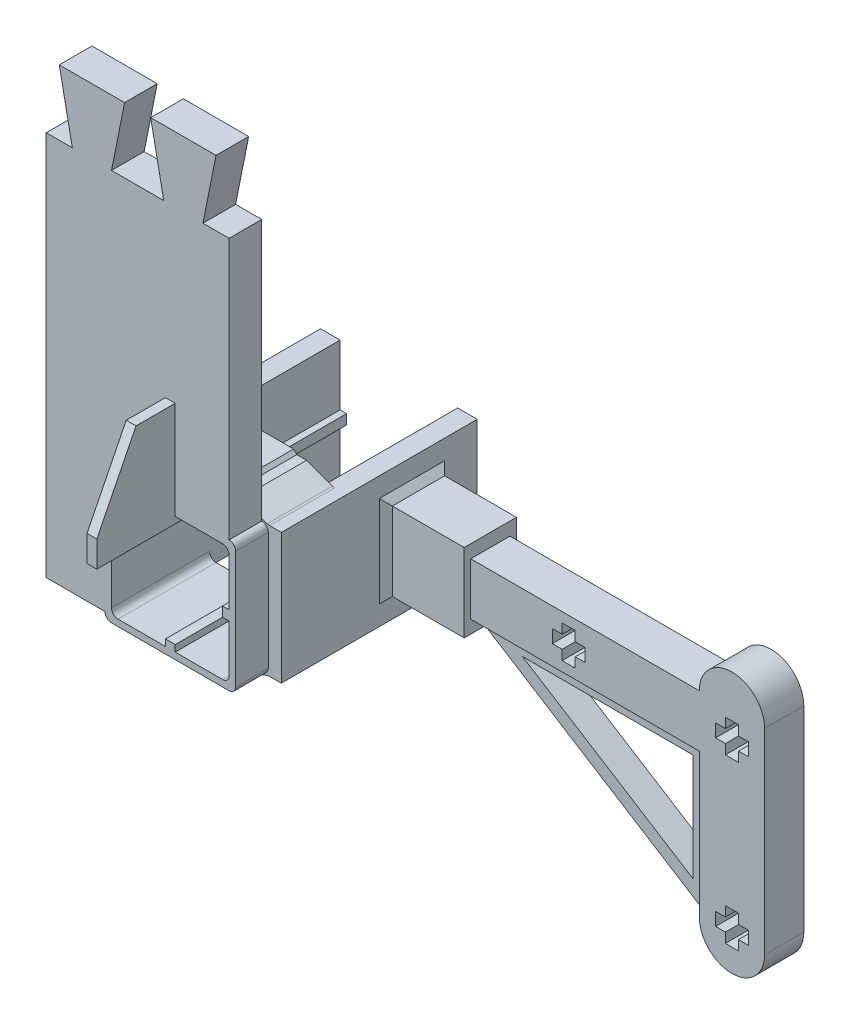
SolidWorks part; units mm, degrees
ref_plane "前视基准面" through (0, 0, 0) normal (0, 0, 1) x (1, 0, 0)
ref_plane "上视基准面" through (0, 0, 0) normal (0, 1, 0) x (1, 0, 0)
ref_plane "右视基准面" through (0, 0, 0) normal (1, 0, 0) x (0, 0, -1)
sketch "草图1" plane through (0, 0, 0) normal (0, 0, 1) x (1, 0, 0)
  line L0 (-10, 10) -> (-10, -10)
  line L1 (9, 9) -> (-9, 9)
  line L2 (9, 9) -> (9, -9)
  line L3 (9, -9) -> (-9, -9)
  line L4 (-9, 9) -> (-9, -9)
  line L5 (9, 9) -> (-9, -9) construction
  line L6 (9, -9) -> (-9, 9) construction
  line L7 (10, -10) -> (-10, -10)
  line L8 (10, 10) -> (10, -10)
  line L9 (10, 10) -> (-10, 10)
  line L10 (-10, 10) -> (-11.5, 5.8788)
  line L11 (-11.5, -4.3788) -> (-12, -3.8788)
  line L12 (-11.5, 5.8788) -> (-11.5, 4.3788)
  line L13 (-11.5, 4.3788) -> (-12, 3.8788)
  line L14 (-12, 3.8788) -> (-12, -3.8788)
  line L15 (-12, 0) -> (0, 0) construction
  line L16 (-11.5, -5.8788) -> (-11.5, -4.3788)
  line L17 (-10, -10) -> (-11.5, -5.8788)
  line L18 (10, 10) -> (5.8788, 11.5)
  line L19 (5.8788, 11.5) -> (4.3788, 11.5)
  line L20 (4.3788, 11.5) -> (3.8788, 12)
  line L21 (3.8788, 12) -> (-3.8788, 12)
  line L22 (-4.3788, 11.5) -> (-3.8788, 12)
  line L23 (-5.8788, 11.5) -> (-4.3788, 11.5)
  line L24 (-10, 10) -> (-5.8788, 11.5)
  line L25 (10, -10) -> (11.5, -5.8788)
  line L26 (11.5, -5.8788) -> (11.5, -4.3788)
  line L27 (11.5, -4.3788) -> (12, -3.8788)
  line L28 (12, -3.8788) -> (12, 3.8788)
  line L29 (11.5, 4.3788) -> (12, 3.8788)
  line L30 (11.5, 5.8788) -> (11.5, 4.3788)
  line L31 (10, 10) -> (11.5, 5.8788)
  line L32 (-10, -10) -> (-5.8788, -11.5)
  line L33 (-5.8788, -11.5) -> (-4.3788, -11.5)
  line L34 (-4.3788, -11.5) -> (-3.8788, -12)
  line L35 (-3.8788, -12) -> (3.8788, -12)
  line L36 (4.3788, -11.5) -> (3.8788, -12)
  line L37 (5.8788, -11.5) -> (4.3788, -11.5)
  line L38 (10, -10) -> (5.8788, -11.5)
  point P0 (0, 0)
  point P45 (0, 0)
  dimension "D1" = 18
  dimension "D2" = 18
  dimension "D4" = 2
  dimension "D5" = 0.5
  dimension "D6" = 20
  dimension "D7" = 1.5
  dimension "D8" = 135
  dimension "D3" = 1
  dimension "D9" = 4
extrude "凸台-拉伸1" add sketch "草图1" along normal blind 10 contours L24 L9 L18 L19 L20 L21 L22 L23 | L8 L9 L0 L7 L4 L1 L2 L3 | L38 L7 L32 L33 L34 L35 L36 L37 | L17 L0 L10 L12 L13 L14 L11 L16
sketch "草图2" plane through (0, 0, 0) normal (0, 0, -1) x (-1, 0, 0)
  line L0 (-10, 10) -> (-12, 10)
  line L1 (-12, 10) -> (-12, -10)
  line L2 (-12, -10) -> (-10, -10)
  line L3 (-10, -10) -> (-10, 10)
  dimension "D1" = 2
extrude "凸台-拉伸2" add sketch "草图2" against normal blind 10
sketch "草图3" plane through (0, 0, 0) normal (0, 0, -1) x (-1, 0, 0)
  line L0 (-9, 9) -> (-9, -9) construction
  line L1 (-12, 10) -> (-9, 10)
  line L2 (-12, 10) -> (-12, -10)
  line L3 (-12, -10) -> (-9, -10)
  line L4 (-9, 10) -> (-9, -10)
extrude "凸台-拉伸3" add sketch "草图3" along normal blind 20
fillet "圆角1" radius 1 8 edges at (-9, -9, 5) (-9, 9, 5) (9, 9, 5) (9, -9, 5) (-10, 10, 5) (-10, -10, 5) (10, -10, 5) (10, 10, 5)
sketch "草图4" plane through (0, 0, 0) normal (0, 0, -1) x (-1, 0, 0)
  line L0 (-8, 9) -> (8, 9) construction
  line L1 (0.75, 10) -> (-0.75, 10)
  line L2 (0.75, 10) -> (0.75, 8)
  line L3 (0.75, 8) -> (-0.75, 8)
  line L4 (-0.75, 10) -> (-0.75, 8)
  line L5 (0.75, 10) -> (-0.75, 8) construction
  line L6 (0.75, 8) -> (-0.75, 10) construction
  line L7 (10, 0.75) -> (8, 0.75)
  line L8 (10, -0.75) -> (10, 0.75)
  line L9 (10, -0.75) -> (8, -0.75)
  line L10 (8, -0.75) -> (8, 0.75)
  line L11 (0.75, -10) -> (0.75, -8)
  line L12 (-0.75, -10) -> (0.75, -10)
  line L13 (-0.75, -10) -> (-0.75, -8)
  line L14 (-0.75, -8) -> (0.75, -8)
  line L15 (-10, -0.75) -> (-8, -0.75)
  line L16 (-10, 0.75) -> (-10, -0.75)
  line L17 (-10, 0.75) -> (-8, 0.75)
  line L18 (-8, 0.75) -> (-8, -0.75)
  point P0 (0, 9)
  point P22 (0, 0)
  dimension "D1" = 2
  dimension "D2" = 1.5
  dimension "D3" = 4
extrude "凸台-拉伸4" add sketch "草图4" against normal up to surface (10 mm away)
ref_plane "基准面1" through (0, 0, -10) normal (0, 0, -1) x (-1, 0, 0)
sketch "草图5" plane through (0, 0, -10) normal (0, 0, -1) x (-1, 0, 0)
  line L5 (-12, 10) -> (-12, -10) construction
  line L6 (-24, 6) -> (-12, 6)
  line L7 (-24, 6) -> (-24, -6)
  line L8 (-24, -6) -> (-12, -6)
  line L9 (-12, 6) -> (-12, -6)
  line L10 (-24, 6) -> (-12, -6) construction
  line L11 (-24, -6) -> (-12, 6) construction
  line L12 (-18, 0) -> (0, 0) construction
  point P0 (-18, 0)
  dimension "D1" = 12
  dimension "D2" = 12
extrude "凸台-拉伸8" add sketch "草图5" along normal mid plane 8
sketch "草图8" plane through (24, 0, 0) normal (1, 0, 0) x (0, 0, -1)
  line L0 (0, 0) -> (10, 0) construction
  line L1 (13, 4) -> (7, 4)
  line L2 (13, 4) -> (13, -4)
  line L3 (13, -4) -> (7, -4)
  line L4 (7, 4) -> (7, -4)
  line L5 (13, 4) -> (7, -4) construction
  line L6 (13, -4) -> (7, 4) construction
  line L7 (14, 6) -> (14, -6) construction
  point P0 (10, 0)
  dimension "D1" = 4
  dimension "D2" = 8
  dimension "D3" = 6
extrude "凸台-拉伸9" add sketch "草图8" along normal blind 35
sketch "草图9" plane through (0, 0, -10) normal (0, 0, -1) x (-1, 0, 0)
  line L0 (-64, 4) -> (-64, -26) construction
  line L1 (-59, 4) -> (-59, -26)
  line L2 (-69, 4) -> (-69, -26)
  line L3 (-64, 4) -> (-59, 4) construction
  line L4 (-59, -4) -> (-59, 4) construction
  arc A0 (-59, 4) -> (-69, 4) centre (-64, 4) ccw
  arc A1 (-69, -26) -> (-59, -26) centre (-64, -26) ccw
  point P2 (-64, -11)
  dimension "D1" = 5
  dimension "D2" = 30
extrude "凸台-拉伸10" add sketch "草图9" along normal mid plane 6
chamfer "倒角1" distance 1 angle 45 4 edges at (12, 0, -14) (12, -6, -10) (12, 0, -6) (12, 6, -10)
sketch "草图10" plane through (0, 0, -10) normal (0, 0, -1) x (-1, 0, 0)
  line L0 (-24, -4) -> (-59, -26)
rib "筋1" sketch "草图10" sketch "草图10" thickness 4 extrusion direction parallel to sketch draft on no parameters "D1"=4
sketch "草图11" plane through (0, 0, -10) normal (0, 0, -1) x (-1, 0, 0)
  line L0 (-57, -6) -> (-57, -22.3806)
  line L1 (-57, -22.3806) -> (-30.94, -6)
  line L2 (-30.94, -6) -> (-57, -6)
  line L3 (-24, -4) -> (-59, -4)
  line L4 (-59, -4) -> (-59, -26)
  line L5 (-59, -26) -> (-24, -4)
  line L6 (-24, -4) -> (-59, -4)
  line L7 (-59, -4) -> (-59, -26)
  line L8 (-59, -26) -> (-24, -4)
  dimension "D1" = 0
  dimension "D2" = 2
extrude "切除-拉伸1" cut sketch "草图11" against normal through all both and the other way through all contours L0 L1 L2
sketch "草图13" plane through (0, 0, 10) normal (0, 0, 1) x (1, 0, 0)
  line L1 (8, 9) -> (-8, 9)
  line L2 (9, 8) -> (9, -8)
  line L3 (8, -9) -> (-8, -9)
  line L4 (-9, 8) -> (-9, -8)
  line L5 (9, 9) -> (-9, -9) construction
  line L6 (9, -9) -> (-9, 9) construction
  line L7 (9, 10) -> (-9, 10)
  line L8 (10, 9) -> (10, -9)
  line L9 (9, -10) -> (-9, -10)
  line L10 (-10, 9) -> (-10, -9)
  line L11 (10, 10) -> (-10, -10) construction
  line L12 (10, -10) -> (-10, 10) construction
  arc A0 (-9, 10) -> (-10, 9) centre (-9, 9) ccw
  arc A1 (10, -9) -> (9, -10) centre (9, -9) cw
  arc A2 (9, 10) -> (10, 9) centre (9, 9) cw
  arc A3 (-9, -10) -> (-10, -9) centre (-9, -9) cw
  arc A4 (-8, 9) -> (-9, 8) centre (-8, 8) ccw
  arc A5 (9, -8) -> (8, -9) centre (8, -8) cw
  arc A6 (8, 9) -> (9, 8) centre (8, 8) cw
  arc A7 (-8, -9) -> (-9, -8) centre (-8, -8) cw
  point P0 (0, 0)
  point P6 (0, 0)
  dimension "D5" = 1
  dimension "D1" = 20
  dimension "D2" = 20
  dimension "D3" = 18
  dimension "D4" = 18
extrude "凸台-拉伸11" add sketch "草图13" along normal blind 5
sketch "草图14" plane through (0, 10, 0) normal (0, 1, 0) x (1, 0, 0)
  line L1 (-9, -10) -> (9, -10)
  line L2 (-9, -10) -> (-9, -15)
  line L3 (-9, -15) -> (9, -15)
  line L4 (9, -10) -> (9, -15)
extrude "凸台-拉伸12" add sketch "草图14" along normal blind 50
sketch "草图15" plane through (0, 0, 15) normal (0, 0, 1) x (1, 0, 0)
  line L0 (-9, 60) -> (-9, 10) construction
  line L1 (-9, 60) -> (-9, 10)
  line L2 (-10, 9) -> (-10, -9) construction
  line L3 (-10, 9) -> (-10, -9)
  line L4 (-10, -9) -> (-19, -9)
  line L5 (-19, -9) -> (-19, 60)
  line L6 (-19, 60) -> (-9, 60)
  arc A0 (-9, 10) -> (-10, 9) centre (-9, 9) ccw construction
  arc A1 (-9, 10) -> (-10, 9) centre (-9, 9) ccw
  dimension "D1" = 10
extrude "凸台-拉伸13" add sketch "草图15" against normal up to surface (5 mm away)
sketch "草图17" plane through (0, 0, 15) normal (0, 0, 1) x (1, 0, 0)
  line L0 (9, 60) -> (9, 10) construction
  line L1 (-19, 60) -> (9, 60)
  line L2 (-19, 60) -> (-19, 50)
  line L3 (-19, 50) -> (9, 50)
  line L4 (9, 60) -> (9, 50)
  line L5 (-17, 60) -> (-15, 50)
  line L6 (-9, 50) -> (-7, 60)
  line L7 (-5, 60) -> (-5, 50) construction
  line L8 (-1, 50) -> (-3, 60)
  line L9 (7, 60) -> (5, 50)
  dimension "D1" = 10
  dimension "D2" = 10
  dimension "D3" = 2
  dimension "D4" = 6
  dimension "D5" = 4
extrude "切除-拉伸6" cut sketch "草图17" against normal blind 5 contours L5 L1 L3 M16 | L7 L6 L3 M15 | L1 L7 L3 L8 | L9 L3 M15 M14
sketch "草图18" plane through (0, 0, 0) normal (0, 0, -1) x (-1, 0, 0)
  line L4 (-9, 0.75) -> (-9, -0.75)
  line L5 (-9, -0.75) -> (-8, -0.75)
  line L6 (-8, -0.75) -> (-8, 0.75)
  line L7 (-8, 0.75) -> (-9, 0.75)
  line L8 (-9, 0.75) -> (-9, -0.75)
  line L9 (-9, -0.75) -> (-8, -0.75)
  line L10 (-8, -0.75) -> (-8, 0.75)
  line L11 (-8, 0.75) -> (-9, 0.75)
  dimension "D1" = 0
extrude "凸台-拉伸15" add sketch "草图18" along normal up to surface (20 mm away)
sketch "草图19" plane through (0, 0, -7) normal (0, 0, 1) x (1, 0, 0)
  line L0 (64, 9) -> (64, 0) construction
  line L1 (65, 2.5) -> (65, 1)
  line L2 (66.5, 2.5) -> (61.5, 2.5)
  line L3 (66.5, 2.5) -> (66.5, -2.5)
  line L4 (66.5, -2.5) -> (61.5, -2.5)
  line L5 (61.5, 2.5) -> (61.5, -2.5)
  line L6 (66.5, 2.5) -> (61.5, -2.5) construction
  line L7 (66.5, -2.5) -> (61.5, 2.5) construction
  line L8 (65, 1) -> (66.5, 1)
  line L9 (65, -1) -> (65, -2.5)
  line L10 (66.5, -1) -> (65, -1)
  line L11 (63, -1) -> (61.5, -1)
  line L12 (63, -2.5) -> (63, -1)
  line L13 (63, 1) -> (63, 2.5)
  line L14 (61.5, 1) -> (63, 1)
  arc A0 (69, 4) -> (59, 4) centre (64, 4) ccw construction
  point P25 (64, 0)
  dimension "D1" = 9
  dimension "D2" = 5
  dimension "D3" = 5
  dimension "D4" = 1.5
  dimension "D6" = 2
  dimension "D5" = 4
extrude "切除-拉伸7" cut sketch "草图19" against normal through all both and the other way through all contours L14 L5 L11 L12 L4 L9 L10 L3 L8 L1 L2 L13
pattern_linear "阵列(线性)1" count 2 spacing 25 along (-1, 0, 0) count 2 spacing 25 along (0, -1, 0) of "切除-拉伸7"
sketch "草图20" plane through (0, 0, 10) normal (0, 0, 1) x (1, 0, 0)
  line L4 (-0.75, -9) -> (0.75, -9)
  line L5 (0.75, -9) -> (0.75, -8)
  line L6 (0.75, -8) -> (-0.75, -8)
  line L7 (-0.75, -8) -> (-0.75, -9)
  line L8 (-0.75, -9) -> (0.75, -9)
  line L9 (0.75, -9) -> (0.75, -8)
  line L10 (0.75, -8) -> (-0.75, -8)
  line L11 (-0.75, -8) -> (-0.75, -9)
  line L12 (-9, 0.75) -> (-9, -0.75)
  line L13 (-9, -0.75) -> (-8, -0.75)
  line L14 (-8, -0.75) -> (-8, 0.75)
  line L15 (-8, 0.75) -> (-9, 0.75)
  line L16 (-9, 0.75) -> (-9, -0.75)
  line L17 (-9, -0.75) -> (-8, -0.75)
  line L18 (-8, -0.75) -> (-8, 0.75)
  line L19 (-8, 0.75) -> (-9, 0.75)
  line L20 (0.75, 9) -> (-0.75, 9)
  line L21 (-0.75, 9) -> (-0.75, 8)
  line L22 (-0.75, 8) -> (0.75, 8)
  line L23 (0.75, 8) -> (0.75, 9)
  line L24 (0.75, 9) -> (-0.75, 9)
  line L25 (-0.75, 9) -> (-0.75, 8)
  line L26 (-0.75, 8) -> (0.75, 8)
  line L27 (0.75, 8) -> (0.75, 9)
  line L28 (9, -0.75) -> (9, 0.75)
  line L29 (9, 0.75) -> (8, 0.75)
  line L30 (8, 0.75) -> (8, -0.75)
  line L31 (8, -0.75) -> (9, -0.75)
  line L32 (9, -0.75) -> (9, 0.75)
  line L33 (9, 0.75) -> (8, 0.75)
  line L34 (8, 0.75) -> (8, -0.75)
  line L35 (8, -0.75) -> (9, -0.75)
  dimension "D1" = 0
  dimension "D2" = 0
  dimension "D3" = 0
  dimension "D4" = 0
extrude "凸台-拉伸16" add sketch "草图20" along normal up to surface (5 mm away)
sketch "草图21" plane through (-0.75, 0, 0) normal (-1, 0, 0) x (0, 0, 1)
  line L0 (15, 8) -> (27, 8)
  line L1 (27, 8) -> (27, 12)
  line L2 (27, 12) -> (21, 24)
  line L3 (21, 24) -> (15, 24)
  line L4 (15, 50) -> (15, 10) construction
  line L5 (15, 24) -> (15, 8)
  dimension "D1" = 12
  dimension "D2" = 6
  dimension "D3" = 16
  dimension "D4" = 4
extrude "凸台-拉伸18" add sketch "草图21" against normal blind 1.5
mirror "镜向1" about plane through (0, 0, 0) normal (1, 0, 0) of "凸台-拉伸2", "凸台-拉伸3"
sketch "草图22" plane through (0, 0, 0) normal (0, 0, -1) x (-1, 0, 0)
  line L4 (8, -0.75) -> (9, -0.75)
  line L5 (9, -0.75) -> (9, 0.75)
  line L6 (9, 0.75) -> (8, 0.75)
  line L7 (8, 0.75) -> (8, -0.75)
  line L8 (8, -0.75) -> (9, -0.75)
  line L9 (9, -0.75) -> (9, 0.75)
  line L10 (9, 0.75) -> (8, 0.75)
  line L11 (8, 0.75) -> (8, -0.75)
  dimension "D1" = 0
extrude "凸台-拉伸19" add sketch "草图22" along normal up to surface (20 mm away)
